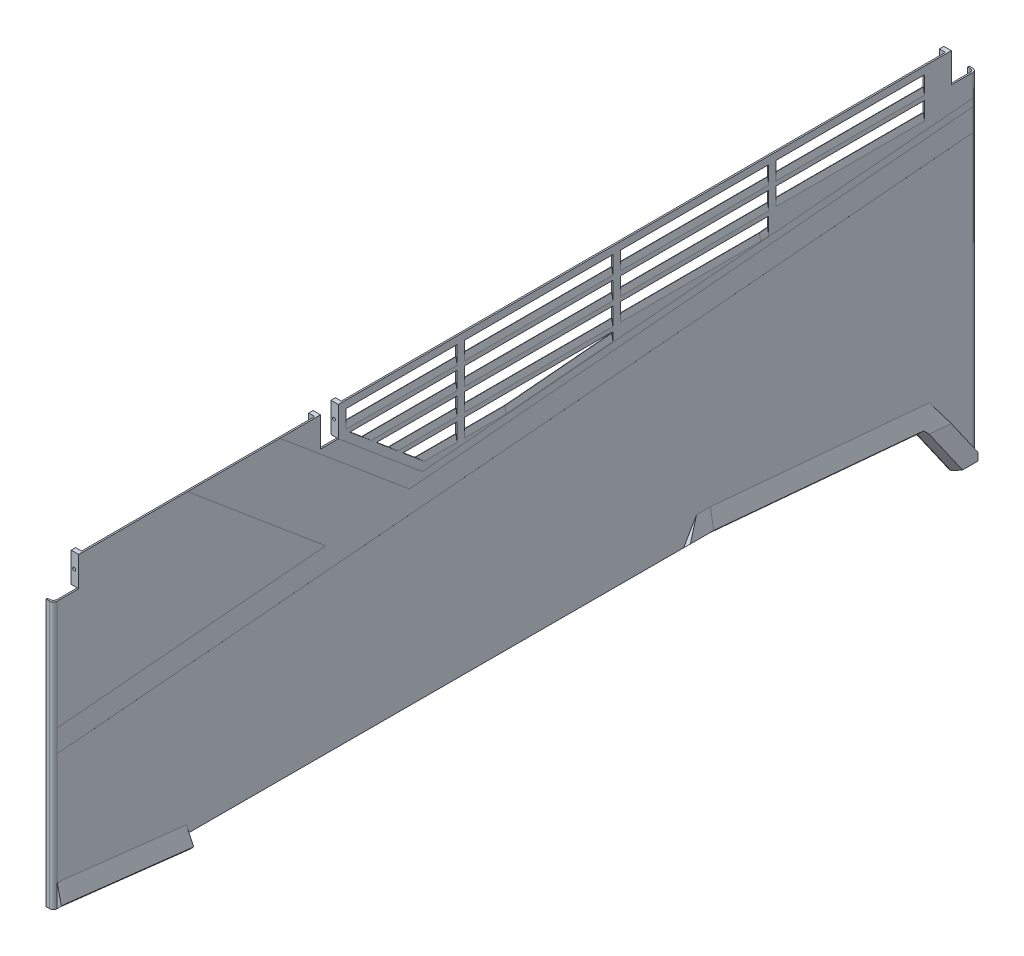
SolidWorks part; units mm, degrees
ref_plane "Front Plane" through (0, 0, 0) normal (0, 0, 1) x (1, 0, 0)
ref_plane "Top Plane" through (0, 0, 0) normal (0, 1, 0) x (1, 0, 0)
ref_plane "Right Plane" through (0, 0, 0) normal (1, 0, 0) x (0, 0, -1)
sketch "Sketch1" plane through (0, 0, 0) normal (1, 0, 0) x (0, 0, -1)
  line L0 (3110, 800) -> (2940, 800)
  line L1 (-3110, -1000) -> (3110, -1000)
  line L2 (-3110, -1000) -> (-3110, 800)
  line L3 (-2940, 1000) -> (-1310, 1000)
  line L4 (3110, -1000) -> (3110, 800)
  line L5 (-3110, -1000) -> (3110, 1000) construction
  line L6 (-3110, 1000) -> (3110, -1000) construction
  line L7 (2940, 800) -> (2940, 1000)
  line L8 (-3110, 800) -> (-2940, 800)
  line L9 (-2940, 800) -> (-2940, 1000)
  line L10 (-2940, 800) -> (-1310, 800) construction
  line L11 (-1310, 800) -> (-1190, 800)
  line L12 (-1190, 800) -> (-1190, 1000)
  line L13 (-1310, 800) -> (-1310, 1000)
  line L14 (-1190, 1000) -> (2940, 1000)
  point P0 (0, 0)
  dimension "D1" = 6220
  dimension "D2" = 2000
  dimension "D3" = 170
  dimension "D4" = 200
  dimension "D5" = 170
  dimension "D6" = 200
  dimension "D7" = 1000
  dimension "D8" = 3110
  dimension "D9" = 1630
  dimension "D10" = 120
extrude "Boss-Extrude1" add sketch "Sketch1" along normal mid plane 10
sketch "Sketch2" plane through (-5, 0, 0) normal (-1, 0, 0) x (0, 0, 1)
  line L0 (3110, -1000) -> (-3110, -1000) construction
  line L1 (-3110, 800) -> (-3100, 800)
  line L2 (-3110, 800) -> (-3110, -1000)
  line L3 (-3110, -1000) -> (-3100, -1000)
  line L4 (-3100, 800) -> (-3100, -1000)
  line L5 (2940, 800) -> (3110, 800) construction
  line L6 (3110, -1000) -> (3100, -1000)
  line L7 (3110, -1000) -> (3110, 800)
  line L8 (3110, 800) -> (3100, 800)
  line L9 (3100, -1000) -> (3100, 800)
  dimension "D1" = 10
  dimension "D2" = 10
extrude "Boss-Extrude2" add sketch "Sketch2" along normal blind 40
fillet "Fillet1" radius 25 4 edges at (-5, -100, 3100) (5, -100, 3110) (5, -100, -3110) (-5, -100, -3100)
sketch "Sketch3" plane through (0, -1000, 0) normal (0, -1, 0) x (1, 0, 0)
  line L16 (5, -3085) -> (5, 3085)
  line L17 (-20, 3110) -> (-45, 3110)
  line L18 (-45, 3110) -> (-45, 3100)
  line L19 (-45, 3100) -> (-30, 3100)
  line L20 (-5, 3075) -> (-5, -3075)
  line L21 (-30, -3100) -> (-45, -3100)
  line L22 (-45, -3100) -> (-45, -3110)
  line L23 (-45, -3110) -> (-20, -3110)
  line L24 (5, -3085) -> (5, 3085)
  line L25 (-20, 3110) -> (-45, 3110)
  line L26 (-45, 3110) -> (-45, 3100)
  line L27 (-45, 3100) -> (-30, 3100)
  line L28 (-5, 3075) -> (-5, -3075)
  line L29 (-30, -3100) -> (-45, -3100)
  line L30 (-45, -3100) -> (-45, -3110)
  line L31 (-45, -3110) -> (-20, -3110)
  arc A6 (5, 3085) -> (-20, 3110) centre (-20, 3085) ccw
  arc A7 (-5, 3075) -> (-30, 3100) centre (-30, 3075) ccw
  arc A8 (-30, -3100) -> (-5, -3075) centre (-30, -3075) ccw
  arc A9 (-20, -3110) -> (5, -3085) centre (-20, -3085) ccw
  arc A10 (5, 3085) -> (-20, 3110) centre (-20, 3085) ccw
  arc A11 (-5, 3075) -> (-30, 3100) centre (-30, 3075) ccw
  arc A12 (-30, -3100) -> (-5, -3075) centre (-30, -3075) ccw
  arc A13 (-20, -3110) -> (5, -3085) centre (-20, -3085) ccw
  dimension "D1" = 0
extrude "Boss-Extrude3" add sketch "Sketch3" along normal blind 450
sketch "Sketch4" plane through (5, 0, 0) normal (1, 0, 0) x (0, 0, -1)
  line L1 (1310, -1000) -> (2710, -1124.4911)
  line L2 (2710, -1124.4911) -> (2937.9238, -1450)
  line L3 (3085, -1450) -> (-3085, -1450) construction
  line L5 (3085, -1450) -> (3110, -1450) construction
  line L8 (1310, -1000) -> (3110, -1000) construction
  line L9 (-2205, -995) -> (1310, -1000)
  line L10 (2940, -995) -> (-2940, -995) construction
  line L11 (-2205, -995) -> (-2187.5139, -1095)
  line L13 (-2205, -995) -> (-3110, -995) construction
  line L14 (-2187.5139, -1095) -> (-3060, -995)
  line L15 (-3060, -995) -> (-3110, -995)
  line L16 (-3110, -995) -> (-3110, -1450)
  line L17 (-3110, -1450) -> (2937.9238, -1450)
  dimension "D1" = 175
  dimension "D2" = 1400
  dimension "D3" = 55
  dimension "D4" = 1800
  dimension "D5" = 3515
  dimension "D6" = 80
  dimension "D7" = 100
  dimension "D8" = 50
extrude "Cut-Extrude1" cut sketch "Sketch4" against normal through all both
sketch "Sketch5" plane through (-5, 0, 0) normal (-1, 0, 0) x (0, 0, 1)
  line L0 (-2940, 1000) -> (1190, 1000) construction
  line L1 (-2940, 1000) -> (-2910, 1000)
  line L2 (-2940, 1000) -> (-2940, 800)
  line L3 (-2940, 800) -> (-2910, 800)
  line L4 (-2910, 1000) -> (-2910, 800)
  line L5 (1190, 1000) -> (1160, 1000)
  line L6 (1190, 1000) -> (1190, 800)
  line L7 (1190, 800) -> (1160, 800)
  line L8 (1160, 1000) -> (1160, 800)
  line L9 (1190, 1000) -> (1190, 800) construction
  line L10 (1310, 1000) -> (2940, 1000) construction
  line L11 (1310, 800) -> (1340, 800)
  line L12 (1310, 800) -> (1310, 1000)
  line L13 (1310, 1000) -> (1340, 1000)
  line L14 (1340, 800) -> (1340, 1000)
  line L16 (2940, 800) -> (2910, 800)
  line L17 (2940, 800) -> (2940, 1000)
  line L18 (2940, 1000) -> (2910, 1000)
  line L19 (2910, 800) -> (2910, 1000)
  dimension "D1" = 30
  dimension "D2" = 30
  dimension "D3" = 30
  dimension "D4" = 30
extrude "Boss-Extrude4" add sketch "Sketch5" along normal blind 40
sketch "Sketch7" plane through (0, 0, 0) normal (0, 0, 1) x (1, 0, 0)
  line L0 (-45, 900) -> (5, 900) construction
  line L1 (-45, 800) -> (-45, 1000) construction
  line L2 (5, 1000) -> (5, 800) construction
  circle A0 centre (-25, 900) radius 10
  dimension "D1" = 20
  dimension "D2" = 30
extrude "Cut-Extrude2" cut sketch "Sketch7" against normal through all both and the other way through all
sketch "Sketch8" plane through (5, 0, 0) normal (1, 0, 0) x (0, 0, -1)
  line L0 (2940, 1000) -> (2940, 800)
  line L1 (2940, 800) -> (3085, 800)
  line L2 (3085, 800) -> (3085, 650)
  line L4 (3085, 650) -> (-624.4694, 325.4635)
  line L5 (-624.4694, 325.4635) -> (-1190, 800)
  line L6 (-1190, 800) -> (-1190, 1000)
  line L7 (-1190, 1000) -> (2940, 1000)
  line L8 (3085, -1450) -> (3085, 800) construction
  dimension "D1" = 150
  dimension "D2" = 130
  dimension "D3" = 95
extrude "Cut-Extrude3" cut sketch "Sketch8" against normal blind 0.001
sketch "Sketch9" plane through (4.999, 0, 0) normal (1, 0, 0) x (0, 0, -1)
  line L5 (-1190, 1000) -> (-1190, 800) construction
  line L6 (-1190, 800) -> (-624.4694, 325.4635) construction
  line L15 (2940, 1000) -> (-1190, 1000) construction
  line L37 (-624.4694, 325.4635) -> (3085, 650) construction
  line L63 (1710, 950) -> (1760, 950) construction
  line L64 (660, 488.031) -> (1654.0605, 575) construction
  line L65 (660, 950) -> (710, 950) construction
  line L66 (-390, 575) -> (-390, 500) construction
  line L67 (-390, 725) -> (-390, 650) construction
  line L68 (-340, 800) -> (-340, 875) construction
  line L69 (-390, 800) -> (-340, 800) construction
  line L70 (-390, 875) -> (-390, 800) construction
  line L71 (-340, 425) -> (-60.4474, 425)
  line L72 (2760, 800) -> (2760, 725)
  line L73 (1760, 725) -> (2760, 725)
  line L74 (1760, 800) -> (1760, 725)
  line L75 (1760, 800) -> (2760, 800)
  line L76 (2760, 950) -> (2760, 875)
  line L77 (1760, 875) -> (2760, 875)
  line L78 (1760, 950) -> (1760, 875)
  line L79 (1760, 950) -> (2760, 950)
  line L80 (1654.0605, 575) -> (1710, 579.8941)
  line L81 (1710, 650) -> (1710, 579.8941)
  line L82 (710, 575) -> (1654.0605, 575)
  line L83 (710, 650) -> (710, 575)
  line L84 (710, 650) -> (1710, 650)
  line L85 (1710, 800) -> (1710, 725)
  line L86 (710, 725) -> (1710, 725)
  line L87 (710, 800) -> (710, 725)
  line L88 (710, 800) -> (1710, 800)
  line L89 (1710, 950) -> (1710, 875)
  line L90 (710, 875) -> (1710, 875)
  line L91 (710, 950) -> (710, 875)
  line L92 (710, 950) -> (1710, 950)
  line L93 (-340, 500) -> (-340, 425)
  line L94 (660, 500) -> (-340, 500)
  line L95 (660, 488.031) -> (-60.4474, 425)
  line L96 (660, 488.031) -> (660, 500)
  line L97 (660, 650) -> (660, 575)
  line L98 (-340, 575) -> (660, 575)
  line L99 (-340, 650) -> (-340, 575)
  line L100 (-340, 650) -> (660, 650)
  line L101 (660, 800) -> (660, 725)
  line L102 (-340, 725) -> (660, 725)
  line L103 (-340, 800) -> (-340, 725)
  line L104 (-340, 800) -> (660, 800)
  line L105 (660, 875) -> (660, 950)
  line L106 (-340, 950) -> (660, 950)
  line L107 (-340, 875) -> (-340, 950)
  line L108 (-340, 875) -> (660, 875)
  line L109 (-1022.8323, 725) -> (-1112.2138, 800)
  line L110 (-844.0693, 575) -> (-933.4508, 650)
  line L111 (-390, 500) -> (-754.6877, 500)
  line L112 (-390, 425) -> (-665.3062, 425)
  line L113 (-390, 500) -> (-390, 425)
  line L114 (-390, 575) -> (-844.0693, 575)
  line L115 (-390, 650) -> (-390, 575)
  line L116 (-390, 650) -> (-933.4508, 650)
  line L117 (-390, 725) -> (-1022.8323, 725)
  line L118 (-390, 800) -> (-390, 725)
  line L119 (-665.3062, 425) -> (-754.6877, 500)
  line L120 (-390, 800) -> (-1112.2138, 800)
  line L121 (-390, 950) -> (-390, 875)
  line L122 (-1140, 875) -> (-390, 875)
  line L123 (-1140, 950) -> (-1140, 875)
  line L124 (-1140, 950) -> (-390, 950)
  dimension "D1" = 750
  dimension "D2" = 1000
  dimension "D3" = 1000
  dimension "D4" = 1000
  dimension "D5" = 75
  dimension "D6" = 75
  dimension "D7" = 75
  dimension "D8" = 75
  dimension "D9" = 50
  dimension "D10" = 50
  dimension "D11" = 50
  dimension "D12" = 50
  dimension "D13" = 75
  dimension "D14" = 50
  dimension "D15" = 50
  dimension "D16" = 75
  dimension "D17" = 75
  dimension "D18" = 75
  dimension "D19" = 50
extrude "Cut-Extrude4" cut sketch "Sketch9" against normal through all both
chamfer "Chamfer1" distance 45 angle 10 14 edges at (4.999, 425, 200.2237) (4.999, 425, 527.6531) (4.999, 575, 617.0346) (4.999, 725, -160) (4.999, 575, -160) (4.999, 577.447, -1682.0302) (4.999, 575, -1182.0302) (4.999, 725, -1210) (4.999, 725, -2260) (4.999, 875, -2260) (4.999, 875, -1210) (4.999, 875, -160) (4.999, 725, 706.4161) (4.999, 875, 765)
sketch "Sketch12" plane through (-5, 0, 0) normal (-1, 0, 0) x (0, 0, 1)
  line L0 (-2940, 800) -> (-2910, 800) construction
  line L1 (-2960, 240) -> (-2945, 240)
  line L2 (-2960, 240) -> (-2960, 260)
  line L3 (-2960, 260) -> (-2945, 260)
  line L4 (-2945, 240) -> (-2945, 260)
  line L5 (-2960, 240) -> (-2945, 260) construction
  line L6 (-2960, 260) -> (-2945, 240) construction
  line L7 (-2935, 240) -> (-2920, 240)
  line L8 (-2935, 240) -> (-2935, 260)
  line L9 (-2935, 260) -> (-2920, 260)
  line L10 (-2920, 240) -> (-2920, 260)
  line L11 (-2935, 240) -> (-2920, 260) construction
  line L12 (-2935, 260) -> (-2920, 240) construction
  line L13 (1170, 240) -> (1185, 240)
  line L14 (1170, 240) -> (1170, 260)
  line L15 (1170, 260) -> (1185, 260)
  line L16 (1185, 240) -> (1185, 260)
  line L17 (1170, 240) -> (1185, 260) construction
  line L18 (1170, 260) -> (1185, 240) construction
  line L19 (1195, 240) -> (1210, 240)
  line L20 (1195, 240) -> (1195, 260)
  line L21 (1195, 260) -> (1210, 260)
  line L22 (1210, 240) -> (1210, 260)
  line L23 (1195, 240) -> (1210, 260) construction
  line L24 (1195, 260) -> (1210, 240) construction
  line L25 (2920, 240) -> (2935, 240)
  line L26 (2920, 240) -> (2920, 260)
  line L27 (2920, 260) -> (2935, 260)
  line L28 (2935, 240) -> (2935, 260)
  line L29 (2920, 240) -> (2935, 260) construction
  line L30 (2920, 260) -> (2935, 240) construction
  line L31 (2945, 240) -> (2960, 240)
  line L32 (2945, 240) -> (2945, 260)
  line L33 (2945, 260) -> (2960, 260)
  line L34 (2960, 240) -> (2960, 260)
  line L35 (2945, 240) -> (2960, 260) construction
  line L36 (2945, 260) -> (2960, 240) construction
  line L37 (-2945, 240) -> (-2945, 250) construction
  line L38 (-2935, 240) -> (-2935, 250) construction
  line L39 (1185, 240) -> (1185, 250) construction
  line L40 (1195, 240) -> (1195, 250) construction
  line L41 (2935, 240) -> (2935, 250) construction
  line L42 (2945, 240) -> (2945, 250) construction
  point P0 (-2952.5, 250)
  point P5 (-2927.5, 250)
  point P10 (1177.5, 250)
  point P15 (1202.5, 250)
  point P20 (2927.5, 250)
  point P25 (2952.5, 250)
  dimension "D1" = 15
  dimension "D2" = 15
  dimension "D3" = 20
  dimension "D4" = 20
  dimension "D5" = 15
  dimension "D6" = 15
  dimension "D7" = 20
  dimension "D8" = 20
  dimension "D9" = 15
  dimension "D10" = 15
  dimension "D11" = 20
  dimension "D12" = 20
  dimension "D13" = 560
extrude "Boss-Extrude5" add sketch "Sketch12" along normal blind 30
fillet "Fillet2" radius 10 12 edges at (-35, 240, 2952.5) (-35, 240, 2927.5) (-35, 260, 2952.5) (-35, 260, 2927.5) (-35, 240, 1202.5) (-35, 240, 1177.5) (-35, 260, 1202.5) (-35, 260, 1177.5) (-35, 240, -2927.5) (-35, 240, -2952.5) (-35, 260, -2927.5) (-35, 260, -2952.5)
sketch "Sketch13" plane through (0, 0, 0) normal (0, 0, 1) x (1, 0, 0)
  circle A0 centre (-25, 250) radius 5
  dimension "D1" = 10
extrude "Cut-Extrude5" cut sketch "Sketch13" against normal mid plane 6000
sketch "Sketch14" plane through (5, 0, 0) normal (1, 0, 0) x (0, 0, -1)
  line L0 (3085, -1450) -> (3085, -1398.5296)
  line L1 (3085, -1450) -> (3085, 650) construction
  line L39 (3085, -1450) -> (2937.9238, -1450)
  line L40 (2937.9238, -1450) -> (2710, -1124.4911)
  line L41 (1316.7625, -850.0095) -> (-2204.7866, -845.0002)
  line L42 (3060.7966, -1363.9635) -> (2792.8278, -981.2645)
  line L43 (2792.8278, -981.2645) -> (1316.7625, -850.0095)
  line L44 (1316.7625, -850.0095) -> (1223.6109, -849.877)
  line L45 (3085, -1398.5296) -> (2792.8278, -981.2645)
  line L46 (2792.8278, -981.2645) -> (1316.7625, -850.0095)
  line L47 (2710, -1124.4911) -> (1310, -1000)
  line L48 (1310, -1000) -> (1136.7951, -999.7536)
  line L49 (1310, -1000) -> (-2205, -995) construction
  line L50 (1136.7951, -999.7536) -> (1223.6109, -849.877)
  line L51 (1310, -1000) -> (1180.203, -924.8153) construction
  line L56 (-2187.5139, -1095) -> (-2214.4547, -940.9302)
  line L57 (-2205, -995) -> (-2187.5139, -1095) construction
  line L58 (-3051.4319, -845) -> (-3085, -845)
  line L59 (-2170.4335, -945.9756) -> (-3051.4319, -845)
  line L60 (-3051.4319, -845) -> (-3085, -845)
  line L61 (-2214.4547, -940.9302) -> (-3051.4319, -845)
  line L62 (-3085, -845) -> (-3085, -995)
  line L63 (-3085, -995) -> (-3060, -995)
  line L64 (-3060, -995) -> (-2187.5139, -1095)
  dimension "D2" = 150
  dimension "D3" = 60
  dimension "D1" = 150
  dimension "D4" = 150
extrude "Boss-Extrude6" add sketch "Sketch14" along normal blind 35 separate body
chamfer "Chamfer2" distance 35 angle 45 3 edges at (40, -1062.2455, -2010) (40, -999.8768, -1223.3975) (40, -1287.2455, -2823.9619)
chamfer "Chamfer3" distance 35 angle 45 2 edges at (40, -995, 3072.5) (40, -1045, 2623.757)
chamfer "Chamfer4" distance 35 distance2 150 1 edges at (40, -892.9651, 2632.9433)
chamfer "Chamfer5" distance 35 distance2 150 2 edges at (40, -915.637, -2054.7952) (40, -849.9432, -1270.1867)
sketch "Sketch15" plane through (5, 0, 0) normal (1, 0, 0) x (0, 0, -1)
  line L18 (-620.1116, 275.6537) -> (3089.3578, 600.1903)
  line L19 (-3085, 60.004) -> (-1274.7179, 218.3831)
  line L20 (-3085, 800) -> (-3085, -995) construction
  line L21 (3085, -1450) -> (3085, 650) construction
  line L22 (-3085, -90.569) -> (3085, 449.236)
  line L23 (-3071.9266, -89.4253) -> (3098.0734, 450.3798) construction
  line L24 (3085, 599.809) -> (3085, 449.236)
  line L25 (-3085, 60.004) -> (-3085, -90.569)
  line L28 (-1310, 1000) -> (-2940, 1000) construction
  line L29 (-1254.2788, 723.3956) -> (-688.7482, 248.859)
  line L30 (-1583.9231, 1000) -> (-711.1851, 267.6858)
  line L31 (-2206.2126, 1000) -> (-1274.7179, 218.3831)
  line L32 (-1841.0381, 693.5822) -> (-968.3001, -38.7319) construction
  line L33 (-711.1851, 267.6858) -> (3085, 599.809)
  line L34 (-3085, 60.004) -> (3085, 599.809) construction
  line L35 (-2206.2126, 1000) -> (-1583.9231, 1000)
  dimension "D1" = 50
  dimension "D2" = 150
  dimension "D3" = 100
  dimension "D4" = 400
extrude "Cut-Extrude6" cut sketch "Sketch15" against normal blind 0.05
